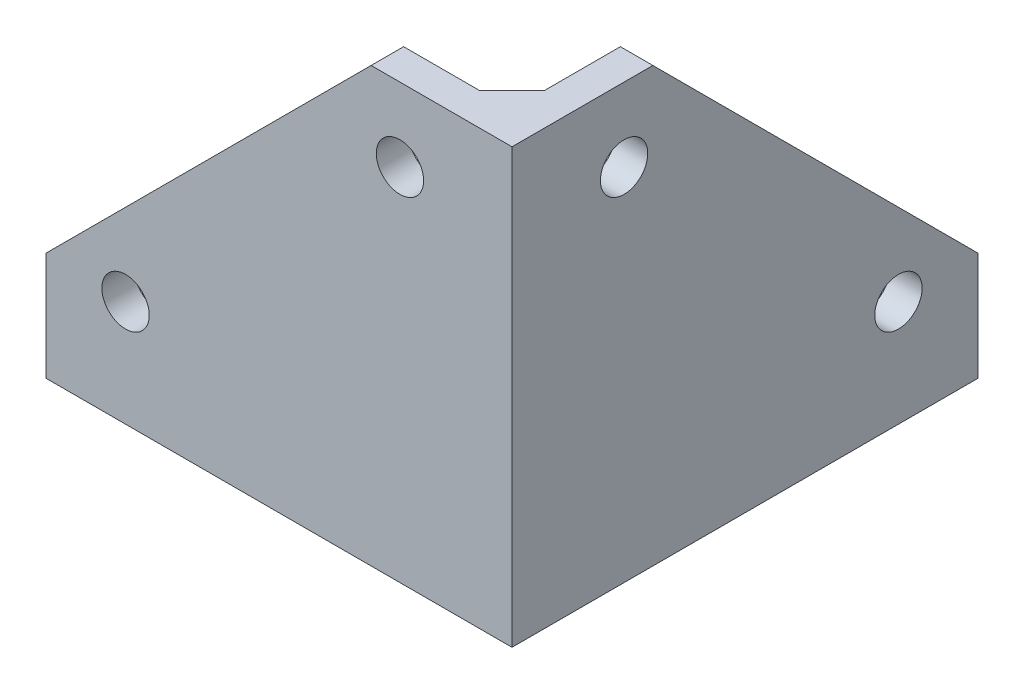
SolidWorks part; units mm, degrees
ref_plane "Front Plane" through (0, 0, 0) normal (0, 0, 1) x (1, 0, 0)
ref_plane "Top Plane" through (0, 0, 0) normal (0, 1, 0) x (1, 0, 0)
ref_plane "Right Plane" through (0, 0, 0) normal (1, 0, 0) x (0, 0, -1)
sketch "Sketch1" plane through (0, 0, 0) normal (0, 1, 0) x (1, 0, 0)
  line L0 (0, 0) -> (20.8781, 0) construction
  line L1 (-14.1978, -14.1978) -> (14.1978, 14.1978)
  line L3 (20, -20) -> (-20, -20)
  line L4 (20, -20) -> (20, 20)
  line L5 (20, 20) -> (-20, 20)
  line L6 (-20, -20) -> (-20, 20)
  line L7 (20, -20) -> (-20, 20) construction
  line L8 (20, 20) -> (-20, -20) construction
  circle A1 centre (14.1978, 14.1978) radius 2.1844
  circle A2 centre (-14.1978, -14.1978) radius 2.1844
  point P6 (0, 0)
extrude "Boss-Extrude1" add sketch "Sketch1" along normal blind 3
sketch "Sketch2" plane through (0, 0, 0) normal (0, 1, 0) x (1, 0, 0)
  line L2 (-20, -20) -> (20, -20)
  line L3 (20, -20) -> (20, 20)
extrude "Extrude-Thin1" add sketch "Sketch2" along normal blind 40 thin
sketch "Sketch3" plane through (20, 0, 0) normal (-1, 0, 0) x (0, 0, 1)
  line L0 (-20, 3) -> (20, 40) construction
  line L1 (20, 40) -> (20, 3) construction
  line L2 (20, 40) -> (20, 3) construction
  line L3 (0, 21.5) -> (-6.3968, 28.4155) construction
  circle A0 centre (12.659, 33.2096) radius 2.1844
  circle A1 centre (-12.659, 9.7904) radius 2.1844
extrude "Cut-Extrude1" cut sketch "Sketch3" against normal through all
sketch "Sketch4" plane through (0, 0, 20) normal (0, 0, -1) x (-1, 0, 0)
  line L0 (-20, 40) -> (20, 3) construction
  line L1 (0, 21.5) -> (2.3631, 24.0547) construction
  circle A0 centre (-12.659, 33.2096) radius 2.1844
  circle A1 centre (12.659, 9.7904) radius 2.1844
extrude "Cut-Extrude2" cut sketch "Sketch4" against normal through all
chamfer "Chamfer1" distance 30 angle 45 2 edges at (-20, 40, 21.5) (21.5, 40, -20)
fillet "Fillet1" radius 30 1 edges at (-20, 1.5, -20)
chamfer "Chamfer3" distance 3 angle 45 3 edges at (20, 21.5, 20) (0, 3, 20) (20, 3, 0)
equation "\"HoleDiameter\"= 0.172in"
equation "\"D3@Sketch1\"=\"HoleDiameter\""
equation "\"D1@Sketch3\"=\"HoleDiameter\""
equation "\"D1@Sketch4\"=\"HoleDiameter\""
